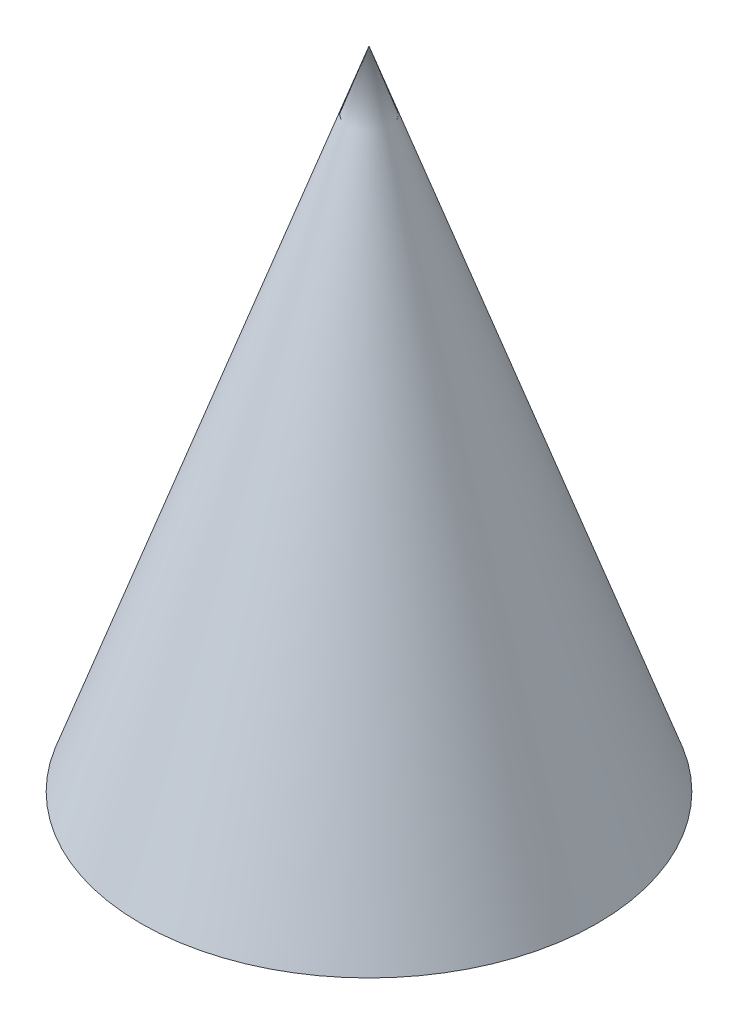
SolidWorks part; units mm, degrees
ref_plane "前视基准面" through (0, 0, 0) normal (0, 0, 1) x (1, 0, 0)
ref_plane "上视基准面" through (0, 0, 0) normal (0, 1, 0) x (1, 0, 0)
ref_plane "右视基准面" through (0, 0, 0) normal (1, 0, 0) x (0, 0, -1)
sketch "草图1" plane through (0, 0, 0) normal (0, 0, 1) x (1, 0, 0)
  line L0 (0, 67.9824) -> (0, -63.5) construction
  line L1 (0, 53.9096) -> (-20, -2.6589)
  line L2 (-20, -2.6589) -> (0, -2.6589)
  line L3 (0, 53.9096) -> (0, -2.6589)
  dimension "D1" = 60
  dimension "D2" = 20
revolve "旋转1" add sketch "草图1" angle 360 about L0
